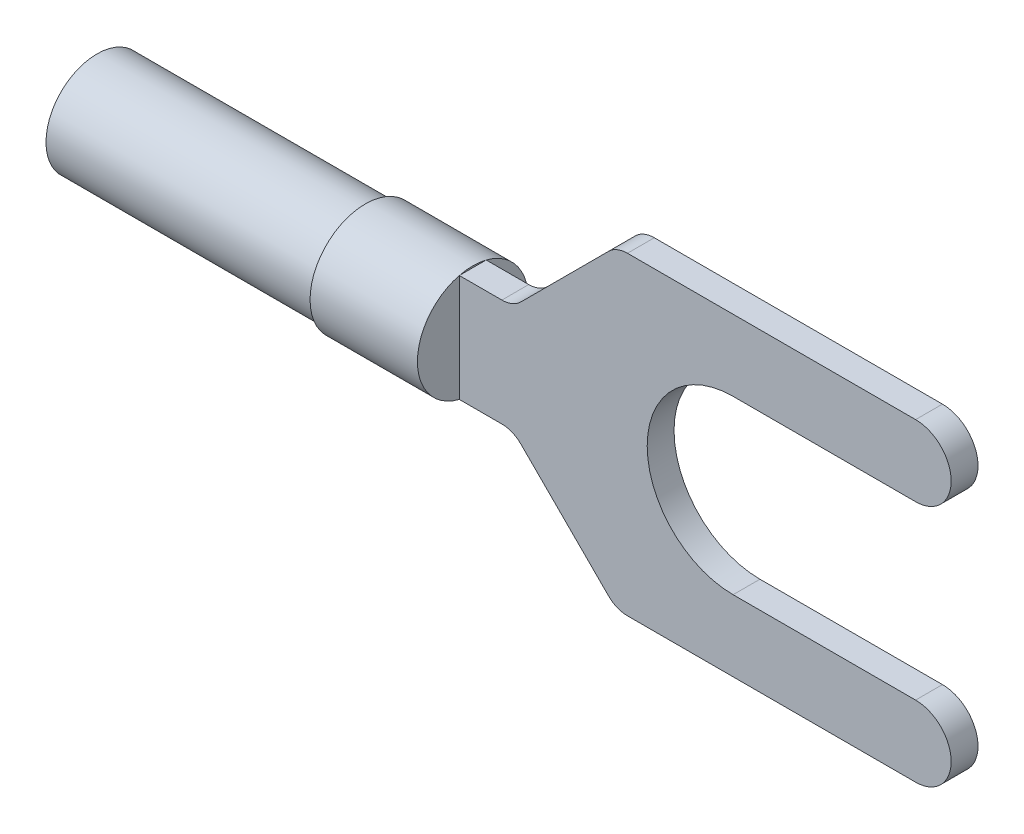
SolidWorks part; units mm, degrees
ref_plane "Plan de face" through (0, 0, 0) normal (0, 0, 1) x (1, 0, 0)
ref_plane "Plan de dessus" through (0, 0, 0) normal (0, 1, 0) x (1, 0, 0)
ref_plane "Plan de droite" through (0, 0, 0) normal (1, 0, 0) x (0, 0, -1)
sketch "Esquisse1" plane through (0, 0, 0) normal (0, 0, 1) x (1, 0, 0)
  line L0 (0, 3.2) -> (6.8, 3.2)
  line L1 (-14.2, 2) -> (-14.2, -2)
  line L2 (6.8, 5.85) -> (-3.9358, 5.85)
  line L3 (-4.6429, 5.5571) -> (-7.9071, 2.2929)
  line L4 (-8.6142, 2) -> (-14.2, 2)
  line L5 (20.7683, 0) -> (-45.9089, 0) construction
  line L6 (-8.6142, -2) -> (-14.2, -2)
  line L7 (-4.6429, -5.5571) -> (-7.9071, -2.2929)
  line L8 (6.8, -5.85) -> (-3.9358, -5.85)
  line L9 (0, -3.2) -> (6.8, -3.2)
  arc A0 (0, 3.2) -> (0, -3.2) centre (0, 0) ccw
  arc A1 (6.8, 3.2) -> (6.8, 5.85) centre (6.8, 4.525) ccw
  arc A2 (6.8, -3.2) -> (6.8, -5.85) centre (6.8, -4.525) cw
  arc A3 (-7.9071, 2.2929) -> (-8.6142, 2) centre (-8.6142, 3) cw
  arc A4 (-3.9358, 5.85) -> (-4.6429, 5.5571) centre (-3.9358, 4.85) ccw
  arc A5 (-8.6142, -2) -> (-7.9071, -2.2929) centre (-8.6142, -3) cw
  arc A6 (-4.6429, -5.5571) -> (-3.9358, -5.85) centre (-3.9358, -4.85) ccw
  point P19 (-14.2, 0)
  point P21 (-8.2, 2)
  point P24 (-4.35, 5.85)
  point P27 (-8.2, -2)
  point P30 (-4.35, -5.85)
  dimension "D8" = 1
  dimension "D1" = 6.4
  dimension "D2" = 11.7
  dimension "D3" = 6.8
  dimension "D4" = 4
  dimension "D5" = 21
  dimension "D6" = 6
  dimension "D7" = 45
extrude "Extrusion1" add sketch "Esquisse1" along normal mid plane 1
sketch "Esquisse2" plane through (-14.2, 0, 0) normal (-1, 0, 0) x (0, 0, 1)
  circle A0 centre (0, 0) radius 2.0616
extrude "Extrusion2" add sketch "Esquisse2" against normal blind 4
sketch "Esquisse3" plane through (-14.2, 0, 0) normal (-1, 0, 0) x (0, 0, 1)
  circle A0 centre (0, 0) radius 1.9
  dimension "D1" = 3.8
extrude "Extrusion3" add sketch "Esquisse3" along normal blind 10
